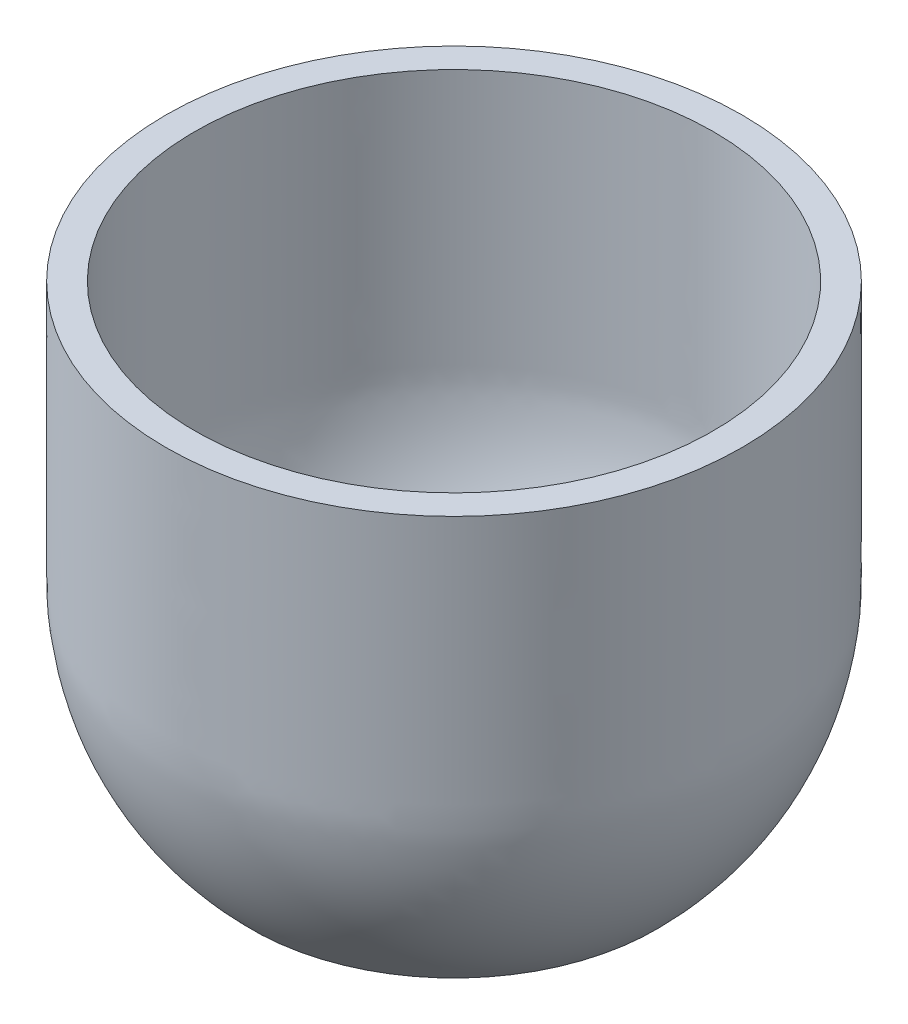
SolidWorks part; units mm, degrees
ref_plane "Front Plane" through (0, 0, 0) normal (0, 0, 1) x (1, 0, 0)
ref_plane "Top Plane" through (0, 0, 0) normal (0, 1, 0) x (1, 0, 0)
ref_plane "Right Plane" through (0, 0, 0) normal (1, 0, 0) x (0, 0, -1)
sketch "Sketch1" plane through (0, 0, 0) normal (0, 0, 1) x (1, 0, 0)
  line L0 (0, 0) -> (0, 80) construction
  line L1 (0, 0) -> (35, 0)
  line L2 (0, 80) -> (50, 80) construction
  line L3 (50, 80) -> (50, 35.7071) construction
  arc A0 (50, 35.7071) -> (35, 0) centre (0, 35.7071) cw construction
  spline S0 degree 3 poles (50, 80) (50, 68.9268) (50, 57.8536) (50, 46.7804) (50, 45.55) (50, 43.0893) (50, 39.3982) (50, 36.9375) (50, 35.7071) (50, 34.6042) (50, 32.3984) (49.5968, 29.088) (49.2326, 26.9112) (49.0147, 25.8301) (47.021, 15.9361) (42.2077, 7.065) (35, 0) knots 0 0 0 0 0.397335 0.397335 0.397335 0.441483 0.485632 0.52978 0.52978 0.52978 0.569355 0.60893 0.648505 0.648505 0.648505 1 1 1 1 weights 1 1 1 1 1 1 1 1 1 1 1 1 1 1 0.970563 0.970563 1
  dimension "D4" = 50
  dimension "D1" = 70
  dimension "D2" = 80
  dimension "D3" = 100
revolve "Cup" add sketch "Sketch1" angle 360 about L0
